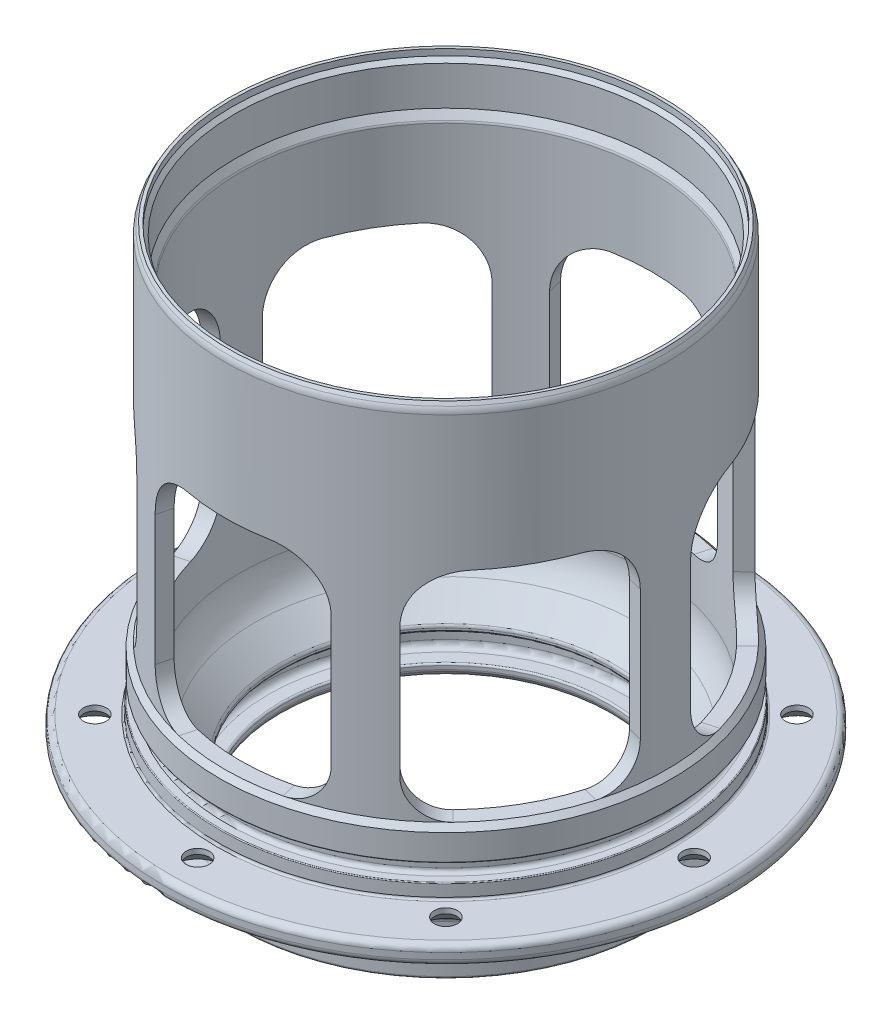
SolidWorks part; units mm, degrees
ref_plane "Plan de face" through (0, 0, 0) normal (0, 0, 1) x (1, 0, 0)
ref_plane "Plan de dessus" through (0, 0, 0) normal (0, 1, 0) x (1, 0, 0)
ref_plane "Plan de droite" through (0, 0, 0) normal (1, 0, 0) x (0, 0, -1)
sketch "Esquisse1" plane through (0, 0, 0) normal (0, 0, 1) x (1, 0, 0)
  line L0 (-120.2567, 137.3869) -> (-120.2567, 54.6295)
  line L1 (-123.5198, 150.5701) -> (-123.0582, 151.3695)
  line L2 (-111.0646, 40.4668) -> (-116.742, 46.1442)
  line L3 (-120.7707, 35.3358) -> (-119.2726, 37.9306)
  line L4 (-123.0582, 151.3695) -> (-122.3217, 151.3657)
  line L5 (-122.3217, 151.3657) -> (-122.3217, 149.8657)
  line L6 (-121.4217, 148.9657) -> (-122.3217, 149.8657)
  line L7 (-121.4217, 148.9657) -> (-121.4217, 139.6726)
  line L8 (-123.9217, 64.874) -> (-123.9217, 149.0701)
  line L9 (-125.1717, 57.524) -> (-125.1717, 63.624)
  line L10 (-125.1717, 53.374) -> (-123.4217, 53.374)
  line L11 (-137.1717, 49.874) -> (-125.8717, 49.874)
  line L12 (-138.6717, 46.874) -> (-138.6717, 48.374)
  line L13 (-119.2726, 41.6267) -> (-121.0031, 44.624)
  line L14 (-119.0717, 40.8767) -> (-119.0717, 38.6806)
  line L15 (-110.6991, 30.374) -> (-120.4717, 30.374)
  line L16 (-114.9967, 34.374) -> (-114.9967, 37.374)
  line L17 (-120.3907, 137.8869) -> (-121.4217, 139.6726)
  line L18 (-123.9217, 64.874) -> (-125.1717, 63.624)
  line L19 (-123.4217, 57.324) -> (-124.9717, 57.324)
  line L20 (-137.1717, 45.374) -> (-122.3021, 45.374)
  line L21 (-110.7717, 39.274) -> (-110.7717, 39.7597)
  line L22 (-120.9717, 30.874) -> (-120.9717, 34.5858)
  line L23 (-113.4967, 38.874) -> (-111.1717, 38.874)
  line L24 (-113.4967, 32.874) -> (-110.5217, 32.874)
  line L25 (-125.3717, 50.374) -> (-125.3717, 53.174)
  line L26 (-122.4217, 54.374) -> (-122.4217, 56.324)
  line L27 (-110.2557, 31.1419) -> (-110.6991, 30.374)
  line L28 (-110.1217, 31.6419) -> (-110.1217, 32.474)
  line L29 (-71.1717, 158.7367) -> (-71.1717, 21.124) construction
  arc A0 (-123.9217, 149.0701) -> (-123.5198, 150.5701) centre (-120.9217, 149.0701) cw
  arc A1 (-114.9967, 34.374) -> (-113.4967, 32.874) centre (-113.4967, 34.374) ccw
  arc A2 (-110.2557, 31.1419) -> (-110.1217, 31.6419) centre (-111.1217, 31.6419) ccw
  arc A3 (-110.1217, 32.474) -> (-110.5217, 32.874) centre (-110.5217, 32.474) ccw
  arc A4 (-120.4717, 30.374) -> (-120.9717, 30.874) centre (-120.4717, 30.874) cw
  arc A5 (-114.9967, 37.374) -> (-113.4967, 38.874) centre (-113.4967, 37.374) cw
  arc A6 (-110.7717, 39.7597) -> (-111.0646, 40.4668) centre (-111.7717, 39.7597) ccw
  arc A7 (-110.7717, 39.274) -> (-111.1717, 38.874) centre (-111.1717, 39.274) cw
  arc A8 (-121.0031, 44.624) -> (-122.3021, 45.374) centre (-122.3021, 43.874) ccw
  arc A9 (-119.2726, 41.6267) -> (-119.0717, 40.8767) centre (-120.5717, 40.8767) cw
  arc A10 (-119.0717, 38.6806) -> (-119.2726, 37.9306) centre (-120.5717, 38.6806) cw
  arc A11 (-120.9717, 34.5858) -> (-120.7707, 35.3358) centre (-119.4717, 34.5858) cw
  arc A12 (-137.1717, 49.874) -> (-138.6717, 48.374) centre (-137.1717, 48.374) ccw
  arc A13 (-138.6717, 46.874) -> (-137.1717, 45.374) centre (-137.1717, 46.874) ccw
  arc A14 (-125.3717, 50.374) -> (-125.8717, 49.874) centre (-125.8717, 50.374) cw
  arc A15 (-125.3717, 53.174) -> (-125.1717, 53.374) centre (-125.1717, 53.174) cw
  arc A16 (-124.9717, 57.324) -> (-125.1717, 57.524) centre (-124.9717, 57.524) cw
  arc A17 (-123.4217, 53.374) -> (-122.4217, 54.374) centre (-123.4217, 54.374) ccw
  arc A18 (-122.4217, 56.324) -> (-123.4217, 57.324) centre (-123.4217, 56.324) ccw
  arc A19 (-120.2567, 137.3869) -> (-120.3907, 137.8869) centre (-121.2567, 137.3869) ccw
  arc A20 (-116.742, 46.1442) -> (-120.2567, 54.6295) centre (-108.2567, 54.6295) cw
  dimension "D1" = 1
  dimension "D2" = 0.4
  dimension "D4" = 0.5
  dimension "D7" = 1.5
  dimension "D8" = 1.5
  dimension "D12" = 1
  dimension "D13" = 0.4
  dimension "D19" = 1.5
  dimension "D20" = 1.5
  dimension "D21" = 0.5
  dimension "D25" = 0.2
  dimension "D26" = 1
  dimension "D36" = 3
  dimension "D37" = 1
  dimension "D39" = 12
  dimension "D3" = 10.85
  dimension "D5" = 30
  dimension "D6" = 1.9
  dimension "D9" = 2.5
  dimension "D10" = 6
  dimension "D11" = 0.65
  dimension "D14" = 30
  dimension "D15" = 30
  dimension "D16" = 15
  dimension "D17" = 17.7
  dimension "D18" = 4.5
  dimension "D22" = 2.95
  dimension "D23" = 4.4
  dimension "D24" = 13.5
  dimension "D27" = 15
  dimension "D28" = 14.75
  dimension "D29" = 1.6
  dimension "D30" = 1.5
  dimension "D31" = 45
  dimension "D32" = 2.5
  dimension "D33" = 3.665
  dimension "D34" = 30
  dimension "D35" = 30
  dimension "D38" = 45
  dimension "D40" = 67.5
revolve "Révolution1" add sketch "Esquisse1" angle 360 about L29
ref_plane "Plan1" through (0, 64.874, 0) normal (0, 1, 0) x (1, 0, 0)
sketch "Esquisse3" plane through (0, 64.874, 0) normal (0, 1, 0) x (1, 0, 0)
  line L0 (-71.1717, 0) -> (-71.1717, -78.1645) construction
  line L1 (-71.1717, -78.1645) -> (-71.1717, 0) construction
  line L2 (-18.764, 6) -> (-22.3444, 5.0236)
  line L3 (-71.1717, 0) -> (-8.6129, 0) construction
  line L4 (-50.164, -48.3864) -> (-51.1086, -44.7974)
  line L5 (-39.7717, -42.3864) -> (-42.4075, -39.7739)
  line L6 (-18.764, -6) -> (-22.3444, -5.0236)
  line L7 (-102.5717, -42.3864) -> (-99.9359, -39.7739)
  line L8 (-92.1794, -48.3864) -> (-91.2348, -44.7974)
  line L9 (-123.5793, 6) -> (-119.9989, 5.0236)
  line L10 (-123.5793, -6) -> (-119.9989, -5.0236)
  line L11 (-92.1794, 48.3864) -> (-91.2348, 44.7974)
  line L12 (-102.5717, 42.3864) -> (-99.9359, 39.7739)
  line L13 (-39.7717, 42.3864) -> (-42.4075, 39.7739)
  line L14 (-50.164, 48.3864) -> (-51.1086, 44.7974)
  arc A0 (-119.9989, -5.0236) -> (-99.9359, -39.7739) centre (-71.1717, 0) ccw
  arc A1 (-92.1794, -48.3864) -> (-50.164, -48.3864) centre (-71.1717, 0) ccw
  arc A2 (-123.5793, -6) -> (-102.5717, -42.3864) centre (-71.1717, 0) ccw
  arc A3 (-91.2348, -44.7974) -> (-51.1086, -44.7974) centre (-71.1717, 0) ccw
  arc A4 (-39.7717, -42.3864) -> (-18.764, -6) centre (-71.1717, 0) ccw
  arc A5 (-42.4075, -39.7739) -> (-22.3444, -5.0236) centre (-71.1717, 0) ccw
  arc A6 (-18.764, 6) -> (-39.7717, 42.3864) centre (-71.1717, 0) ccw
  arc A7 (-22.3444, 5.0236) -> (-42.4075, 39.7739) centre (-71.1717, 0) ccw
  arc A8 (-51.1086, 44.7974) -> (-91.2348, 44.7974) centre (-71.1717, 0) ccw
  arc A9 (-50.164, 48.3864) -> (-92.1794, 48.3864) centre (-71.1717, 0) ccw
  arc A10 (-99.9359, 39.7739) -> (-119.9989, 5.0236) centre (-71.1717, 0) ccw
  arc A11 (-102.5717, 42.3864) -> (-123.5793, 6) centre (-71.1717, 0) ccw
  point P31 (-71.1717, 0)
  point P34 (-71.1717, 0)
  dimension "D3" = 105.5
  dimension "D4" = 98.17
  dimension "D1" = 15.254
  dimension "D2" = 6
  dimension "D5" = 6
extrude "Enlèv. mat.-Extru.2" cut sketch "Esquisse3" along normal blind 52
fillet "Congé1" radius 9 12 edges at (-41.0896, 64.874, 41.0801) (-20.5542, 64.874, 5.5118) (-20.5542, 64.874, -5.5118) (-41.0896, 64.874, -41.0801) (-50.6363, 64.874, -46.5919) (-91.7071, 64.874, -46.5919) (-101.2538, 64.874, -41.0801) (-121.7891, 64.874, -5.5118) (-121.7891, 64.874, 5.5118) (-101.2538, 64.874, 41.0801) (-91.7071, 64.874, 46.5919) (-50.6363, 64.874, 46.5919)
fillet "Congé2" radius 12 12 edges at (-41.0896, 116.874, 41.0801) (-20.5542, 116.874, 5.5118) (-41.0896, 116.874, -41.0801) (-20.5542, 116.874, -5.5118) (-50.6363, 116.874, -46.5919) (-91.7071, 116.874, -46.5919) (-101.2538, 116.874, -41.0801) (-121.7891, 116.874, -5.5118) (-121.7891, 116.874, 5.5118) (-101.2538, 116.874, 41.0801) (-91.7071, 116.874, 46.5919) (-50.6363, 116.874, 46.5919)
hole_wizard "Fraisage pour vis à tête fraisée M51" positions "Esquisse5" profile "Esquisse4" countersink size "M5" standard "Iso"
sketch "Esquisse5" plane through (0, 45.374, 0) normal (0, -1, 0) x (-1, 0, 0)
  circle A0 centre (71.1717, 0) radius 45.5703 construction
  point P0 (11.9217, 0)
  dimension "D1" = 59.25
sketch "Esquisse4" plane through (-11.9217, 45.374, 0) normal (1, 0, 0) x (0, 0, -1)
  line L0 (0, 0) -> (0, 105.9955)
  line L1 (0, 105.9955) -> (2.75, 105.9955)
  line L2 (2.75, 105.9955) -> (2.75, 3.25)
  line L3 (2.75, 3.25) -> (6, 0)
  line L5 (6, 0) -> (0, 0)
  line L6 (-2.75, 3.25) -> (-6, 0) construction
  line L11 (0, -6.35) -> (0, 107.95) construction
  dimension "Diamètre du perçage jusqu'au prochain" = 5.5
  dimension "Profondeur du perçage jusqu'au prochain" = 105.9955
  dimension "Diamètre du fraisage entrant" = 12
  dimension "Angle du fraisage entrant" = 90
pattern_circular "Répétition circulaire1" count 8 over 360 about axis through (-71.1717, 0, 0) along (0, 1, 0) of "Fraisage pour vis à tête fraisée M51"
ref_plane "Plan3" [suppressed] through (0, 151.374, 0) normal (0, 1, 0) x (1, 0, 0)
sketch "Esquisse6" [suppressed] plane through (0, 151.374, 0) normal (0, 1, 0) x (1, 0, 0)
  circle A0 centre (-71.1717, 0) radius 51
  circle A1 centre (-71.1717, 0) radius 52.95
extrude "Boss.-Extru.1" [suppressed] add sketch "Esquisse6" against normal blind 90
